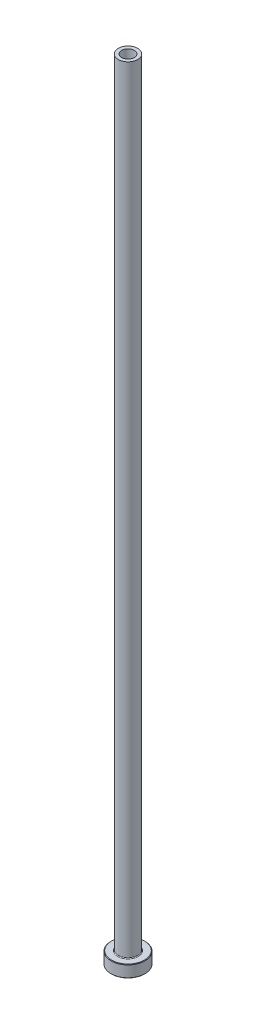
SolidWorks part; units mm, degrees
ref_plane "Front Plane" through (0, 0, 0) normal (0, 0, 1) x (1, 0, 0)
ref_plane "Top Plane" through (0, 0, 0) normal (0, 1, 0) x (1, 0, 0)
ref_plane "Right Plane" through (0, 0, 0) normal (1, 0, 0) x (0, 0, -1)
sketch "Sketch1" plane through (0, 0, 0) normal (0, 0, 1) x (1, 0, 0)
  line L0 (-2.6, 325) -> (-4, 325)
  line L1 (-4, 325) -> (-4, 5)
  line L2 (-4, 5) -> (-7, 5)
  line L3 (-7, 5) -> (-7, 0)
  line L4 (7.7, 0) -> (-7.7, 0) construction
  line L5 (-7, 0) -> (-2.85, 0)
  line L6 (-2.6, 280) -> (-2.6, 325)
  line L7 (0, 92.1877) -> (0, -15.5353) construction
  line L8 (0, -7.7) -> (0, 7.7) construction
  line L9 (-2.6, 280) -> (-2.85, 268)
  line L10 (-2.85, 268) -> (-2.85, 0)
  dimension "D1" = 0.25
  dimension "ID" = 5.2
  dimension "OD" = 8
  dimension "L" = 325
  dimension "H" = 14
  dimension "T" = 5
  dimension "N" = 45
  dimension "D2" = 12
revolve "Revolve1" add sketch "Sketch1" angle 360 about L7
fillet "Fillet1" radius 0.3 1 edges at (0, 5, 4)
chamfer "Chamfer1" distance 0.2 angle 45 2 edges at (0, 5, 7) (0, 0, 7)
chamfer "Chamfer3" distance 0.5 angle 45 1 edges at (0, 0, 2.85)
